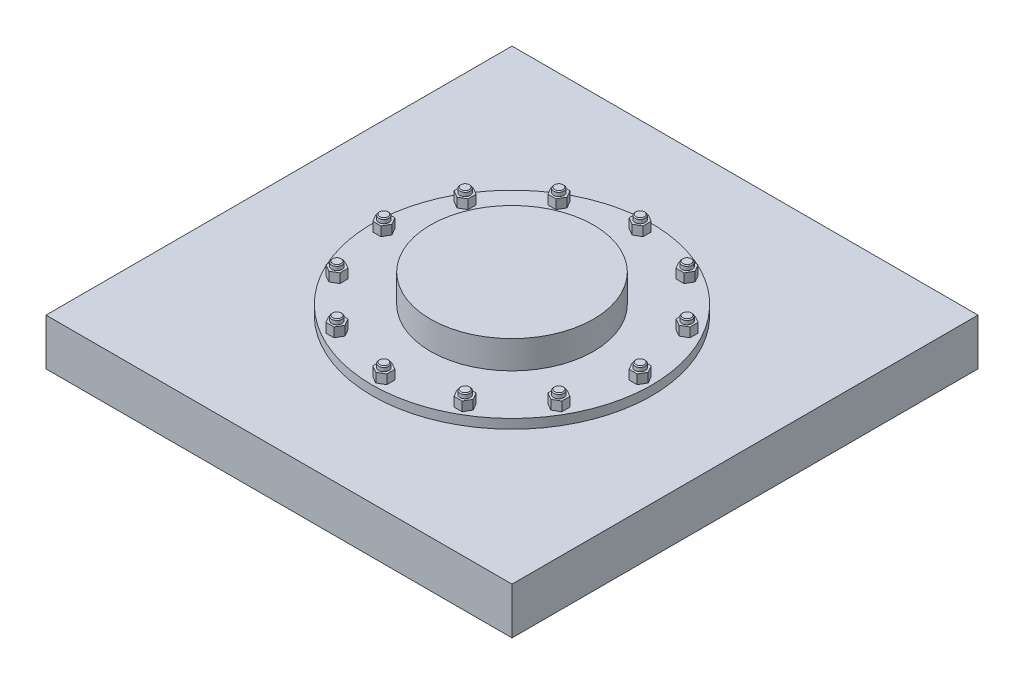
SolidWorks part; units mm, degrees
ref_plane "正面" through (0, 0, 0) normal (0, 0, 1) x (1, 0, 0)
ref_plane "平面" through (0, 0, 0) normal (0, 1, 0) x (1, 0, 0)
ref_plane "右側面" through (0, 0, 0) normal (1, 0, 0) x (0, 0, -1)
sketch "Sketch1" plane through (0, 0, 0) normal (0, 1, 0) x (1, 0, 0)
  line L1 (-500, 500) -> (500, 500)
  line L2 (-500, 500) -> (-500, -500)
  line L3 (-500, -500) -> (500, -500)
  line L4 (500, 500) -> (500, -500)
  point P4 (500, 0)
  dimension "D1" = 500
  dimension "D2" = 1000
  dimension "D3" = 1000
extrude "Extrude1" add sketch "Sketch1" along normal blind 100
sketch "Sketch2" plane through (0, 100, 0) normal (0, 1, 0) x (1, 0, 0)
  circle A0 centre (0, 0) radius 300
  dimension "D1" = 600
extrude "Extrude2" add sketch "Sketch2" along normal blind 20
sketch "Sketch3" plane through (0, 120, 0) normal (0, 1, 0) x (1, 0, 0)
  circle A0 centre (0, 0) radius 175
  dimension "D1" = 350
extrude "Extrude3" add sketch "Sketch3" along normal blind 60
sketch "Sketch4" plane through (0, 120, 0) normal (0, 1, 0) x (1, 0, 0)
  circle A0 centre (275, 0) radius 11
  circle A1 centre (0, 0) radius 275 construction
  dimension "D1" = 22
  dimension "D2" = 550
extrude "Extrude4" add sketch "Sketch4" along normal blind 30
chamfer "Chamfer1" distance 2 angle 45 1 edges at (275, 150, 11)
sketch "Sketch5" plane through (0, 120, 0) normal (0, 1, 0) x (1, 0, 0)
  line L1 (292.3205, 0) -> (283.6603, 15)
  line L2 (283.6603, 15) -> (266.3397, 15)
  line L3 (266.3397, 15) -> (257.6795, 0)
  line L4 (257.6795, 0) -> (266.3397, -15)
  line L5 (266.3397, -15) -> (283.6603, -15)
  line L6 (283.6603, -15) -> (292.3205, 0)
  circle A0 centre (275, 0) radius 15 construction
  dimension "D1" = 30
extrude "Extrude5" add sketch "Sketch5" along normal blind 20
pattern_circular "CirPattern3" count 12 over 360 about axis through (0, 0, 0) along (0, 1, 0) of "Extrude5", "Extrude4", "Chamfer1"
